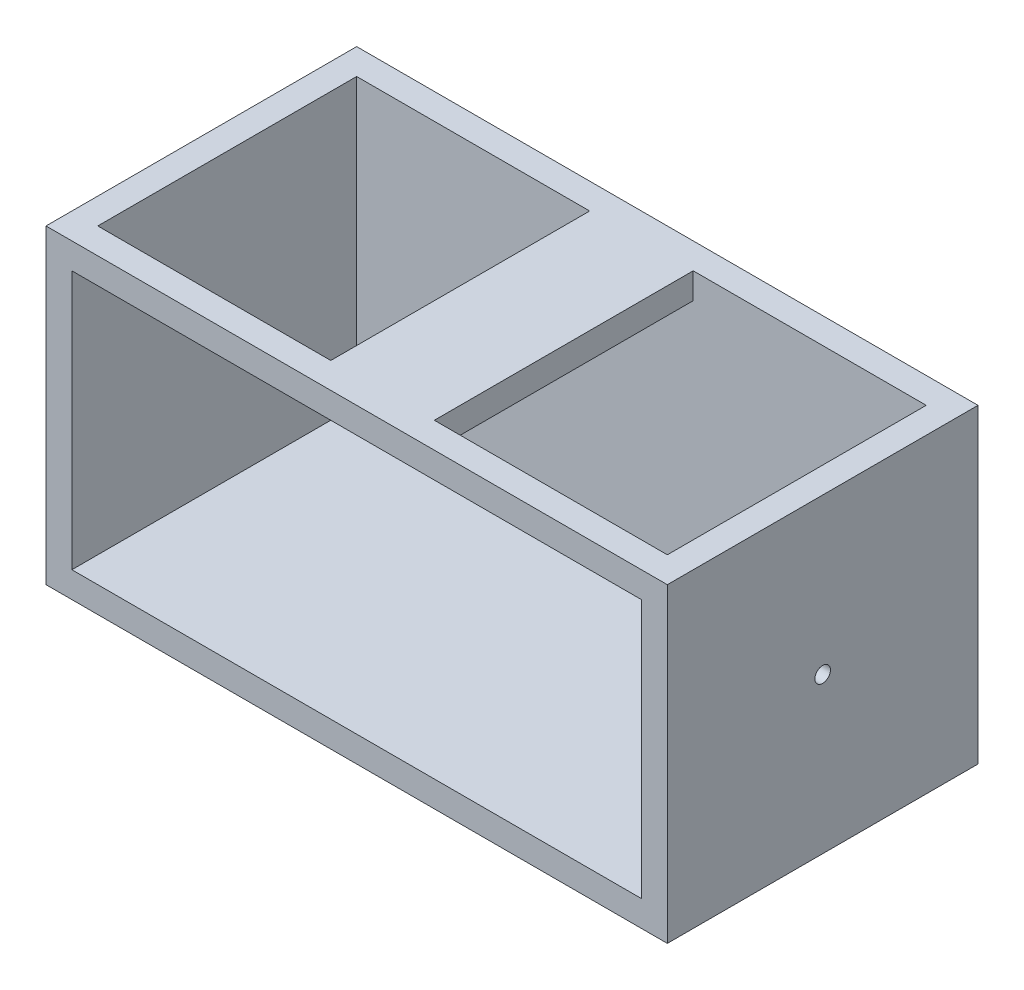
SolidWorks part; units mm, degrees
ref_plane "Front Plane" through (0, 0, 0) normal (0, 0, 1) x (1, 0, 0)
ref_plane "Top Plane" through (0, 0, 0) normal (0, 1, 0) x (1, 0, 0)
ref_plane "Right Plane" through (0, 0, 0) normal (1, 0, 0) x (0, 0, -1)
sketch "Sketch2" plane through (0, 0, 0) normal (0, 0, 1) x (1, 0, 0)
  line L1 (-120, -60) -> (120, -60)
  line L2 (-120, -60) -> (-120, 60)
  line L3 (-120, 60) -> (120, 60)
  line L4 (120, -60) -> (120, 60)
  line L5 (-120, -60) -> (120, 60) construction
  line L6 (-120, 60) -> (120, -60) construction
  point P0 (0, 0)
  dimension "D1" = 120
  dimension "D2" = 240
extrude "Boss-Extrude1" add sketch "Sketch2" along normal blind 120
sketch "Sketch3" plane through (120, 0, 0) normal (1, 0, 0) x (0, 0, -1)
  line L0 (-60, 0) -> (0, 0) construction
  line L1 (0, -60) -> (0, 60) construction
  line L2 (-120, 60) -> (0, 60) construction
  circle A0 centre (-60, 0) radius 3
  point P8 (-60, 60)
  dimension "D1" = 6
extrude "Cut-Extrude1" cut sketch "Sketch3" against normal blind 255
shell "Shell2" thickness 10
sketch "Sketch4" plane through (0, 0, 10) normal (0, 0, 1) x (1, 0, 0)
  line L2 (-110, 50) -> (-110, -50)
  line L3 (-110, -50) -> (110, -50)
  line L4 (110, 50) -> (110, -50)
sketch "Sketch5" plane through (0, 0, 10) normal (0, 0, 1) x (1, 0, 0)
  line L1 (-110, 50) -> (110, 50)
  line L2 (-110, 50) -> (-110, -50)
  line L3 (-110, -50) -> (110, -50)
  line L4 (110, 50) -> (110, -50)
extrude "Cut-Extrude2" cut sketch "Sketch5" along normal blind 158
sketch "Sketch7" plane through (0, 60, 0) normal (0, 1, 0) x (1, 0, 0)
  line L0 (120, -120) -> (120, 0) construction
  line L1 (20, -110) -> (110, -110)
  line L2 (20, -110) -> (20, -10)
  line L3 (20, -10) -> (110, -10)
  line L4 (110, -110) -> (110, -10)
  line L5 (120, 0) -> (-120, 0) construction
  line L6 (120, -120) -> (-120, -120) construction
  dimension "D1" = 10
  dimension "D2" = 10
  dimension "D3" = 10
  dimension "D4" = 90
extrude "Cut-Extrude3" cut sketch "Sketch7" against normal blind 25
sketch "Sketch8" plane through (0, 60, 0) normal (0, 1, 0) x (1, 0, 0)
  line L0 (-110, -10) -> (110, -10) construction
  line L1 (-110, -10) -> (-20, -10)
  line L2 (-110, -10) -> (-110, -110)
  line L3 (-110, -110) -> (-20, -110)
  line L4 (-20, -10) -> (-20, -110)
  line L6 (-120, -120) -> (-120, 0) construction
  line L9 (120, -120) -> (-120, -120) construction
  dimension "D1" = 10
  dimension "D2" = 10
  dimension "D3" = 90
extrude "Cut-Extrude4" cut sketch "Sketch8" against normal blind 25
